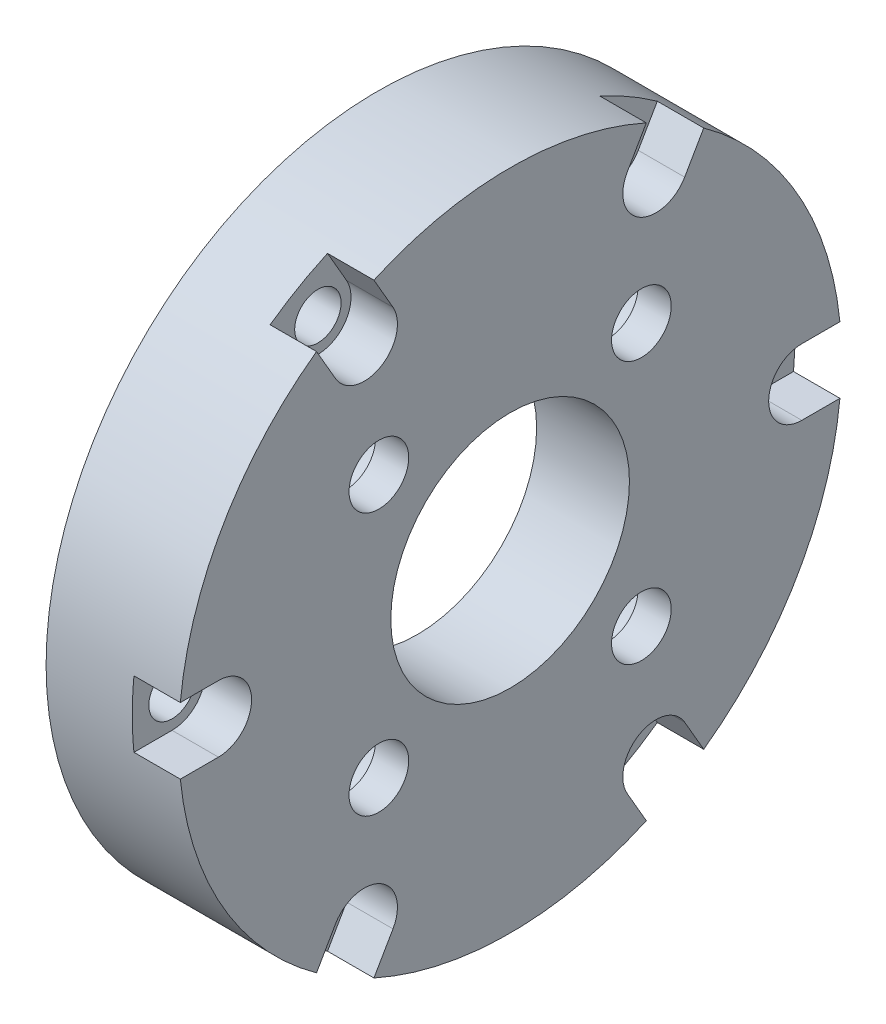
SolidWorks part; units mm, degrees
ref_plane "Plan1" through (0, 0, 0) normal (0, 0, 1) x (1, 0, 0)
ref_plane "Plan2" through (0, 0, 0) normal (0, 1, 0) x (1, 0, 0)
ref_plane "Plan3" through (0, 0, 0) normal (1, 0, 0) x (0, 0, -1)
sketch "Esquisse1" plane through (0, 0, 0) normal (0, 0, 1) x (1, 0, 0)
  line L0 (-5, 25) -> (-5, 19)
  line L1 (-5, 19) -> (-2, 19)
  line L2 (-2, 19) -> (-2, 9)
  line L3 (-2, 9) -> (5, 9)
  line L4 (5, 9) -> (5, 25)
  line L5 (5, 25) -> (-5, 25)
  line L7 (-13, 25) -> (-5, 25) construction
  line L8 (5, 17.9) -> (5, 9) construction
  line L9 (5, 9) -> (2, 9) construction
  line L10 (-3, 19) -> (-3, 8) construction
  line L12 (-5, 25) -> (-5, 19) construction
  line L13 (92.6, 0) -> (-33.4, 0) construction
  line L15 (-14.9364, 0) -> (44.8605, 0) construction
  dimension "D1" = 1
revolve "Base-Révolution" add sketch "Esquisse1" angle 360 about L15
sketch "Esquisse2" plane through (5, 0, 0) normal (1, 0, 0) x (0, 0, -1)
  line L0 (0, 0) -> (-24.5, 0) construction
  line L1 (-22, 2.5) -> (-25.4352, 2.5)
  line L2 (-22, -2.5) -> (-25.4352, -2.5)
  line L3 (-25.4352, -2.5) -> (-25.4352, 2.5)
  circle A0 centre (0, 0) radius 22 construction
  circle A1 centre (0, 0) radius 25 construction
  arc A2 (-22, -2.5) -> (-22, 2.5) centre (-22, 0) ccw
  dimension "D1" = 44
  dimension "D2" = 5
  dimension "D3" = 25.4352
extrude "Enlèv. mat.-Extru.1" cut sketch "Esquisse2" against normal blind 3.5
pattern_circular "Répétition circulaire1" count 6 every 60 about axis through (0, 0, 0) along (1, 0, 0) of "Enlèv. mat.-Extru.1"
sketch "Esquisse3" plane through (1.5, 0, 0) normal (1, 0, 0) x (0, 0, -1)
  circle A0 centre (-22, 0) radius 1.75
  dimension "D1" = 3.5
extrude "Enlèv. mat.-Extru.2" cut sketch "Esquisse3" against normal through all
pattern_circular "Répétition circulaire2" count 6 every 60 about axis through (0, 0, 0) along (1, 0, 0) of "Enlèv. mat.-Extru.2"
sketch "Esquisse4" plane through (-2, 0, 0) normal (-1, 0, 0) x (0, 0, 1)
  point P0 (9.8995, 9.8995)
hole_wizard "Chambrage pour vis à tête cylindrique à 6 pans creux (vis CHC) M41" positions "Esquisse6" profile "Esquisse5" counterbore size "M4" standard "ISO"
sketch "Esquisse6" plane through (-2, 0, 0) normal (-1, 0, 0) x (0, 0, 1)
  point P0 (9.8995, 9.8995)
sketch "Esquisse5" plane through (-2, 9.8995, 9.8995) normal (0, 1, 0) x (0, 0, 1)
  line L0 (0, 0) -> (0, 7)
  line L1 (0, 7) -> (2.25, 7)
  line L3 (2.25, 7) -> (2.25, 4.5)
  line L4 (2.25, 4.5) -> (4, 4.5)
  line L5 (4, 4.5) -> (4, 0)
  line L7 (4, 0) -> (0, 0)
  line L11 (0, -6.35) -> (0, 107.95) construction
  dimension "Diamètre du perçage jusqu'au prochain" = 4.5
  dimension "Profondeur du perçage jusqu'au prochain" = 7
  dimension "Diamètre du chambrage" = 8
  dimension "Profondeur du chambrage" = 4.5
pattern_circular "Répétition circulaire3" count 4 over 360 about axis through (0, 0, 0) along (1, 0, 0) of "Chambrage pour vis à tête cylindrique à 6 pans creux (vis CHC) M41"
